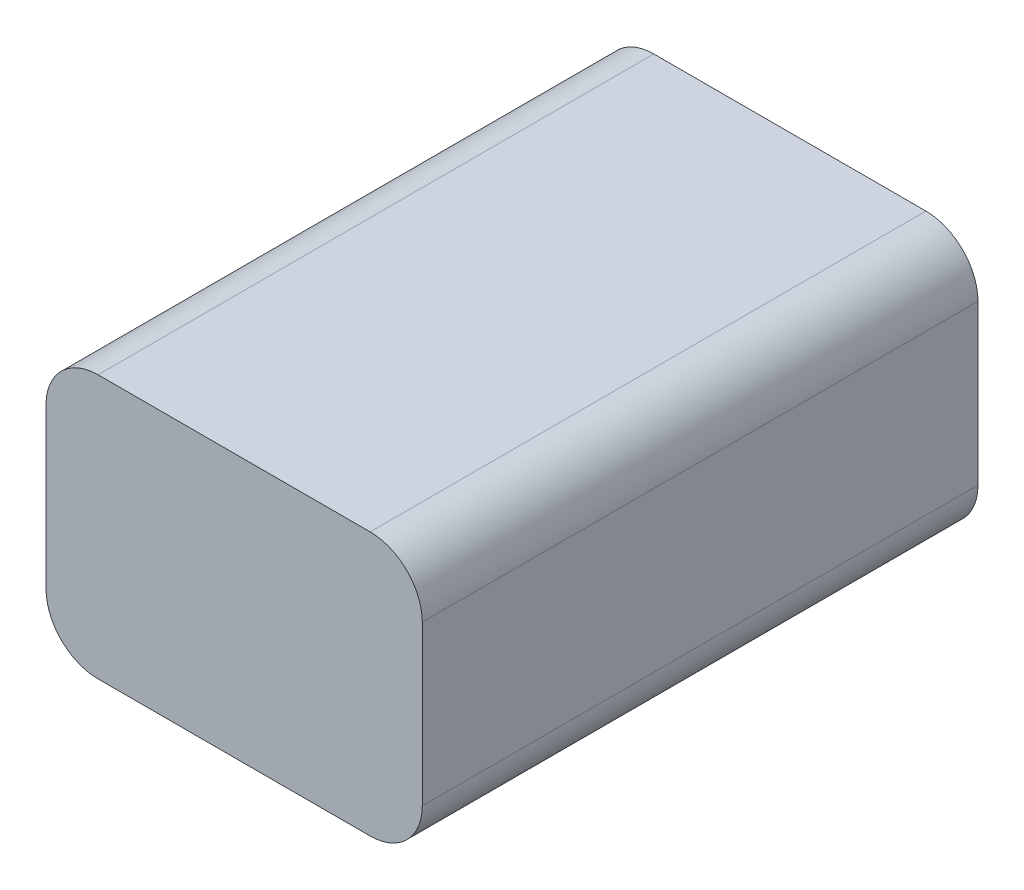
SolidWorks part; units mm, degrees
ref_plane "Front" through (0, 0, 0) normal (0, 0, 1) x (1, 0, 0)
ref_plane "Top" through (0, 0, 0) normal (0, 1, 0) x (1, 0, 0)
ref_plane "Right" through (0, 0, 0) normal (1, 0, 0) x (0, 0, -1)
sketch "Sketch1" plane through (0, 0, 0) normal (0, 0, 1) x (1, 0, 0)
  line L0 (0, 11.375) -> (0, 0) construction
  line L1 (-16.25, 11.375) -> (16.25, 11.375)
  line L2 (-16.25, 11.375) -> (-16.25, -11.375)
  line L3 (-16.25, -11.375) -> (16.25, -11.375)
  line L4 (16.25, 11.375) -> (16.25, -11.375)
  line L5 (0, 0) -> (-16.25, 0) construction
  dimension "D1" = 22.75
  dimension "D2" = 32.5
extrude "Extrude1" add sketch "Sketch1" against normal mid plane 48
fillet "Fillet1" radius 4.5 4 edges at (-16.25, 11.375, 0) (16.25, 11.375, 0) (16.25, -11.375, 0) (-16.25, -11.375, 0)
